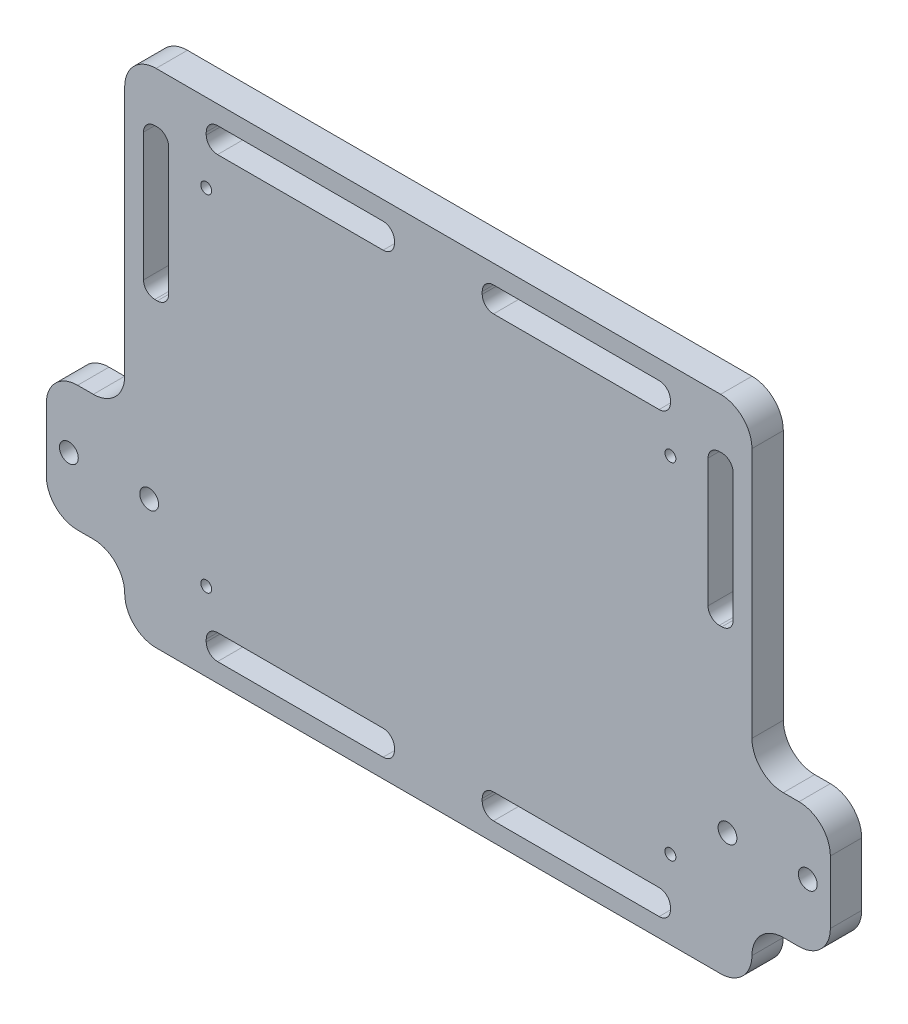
SolidWorks part; units mm, degrees
ref_plane "Front Plane" through (0, 0, 0) normal (0, 0, 1) x (1, 0, 0)
ref_plane "Top Plane" through (0, 0, 0) normal (0, 1, 0) x (1, 0, 0)
ref_plane "Right Plane" through (0, 0, 0) normal (1, 0, 0) x (0, 0, -1)
sketch "Sketch1" plane through (0, 0, 0) normal (0, 0, 1) x (1, 0, 0)
  line L0 (0, -50.8) -> (0, 50.8) construction
  line L1 (-63.5, 50.8) -> (63.5, 50.8)
  line L2 (-63.5, 50.8) -> (-63.5, -50.8)
  line L3 (-63.5, -50.8) -> (63.5, -50.8)
  line L4 (63.5, 50.8) -> (63.5, -50.8)
  line L5 (-63.5, 50.8) -> (63.5, -50.8) construction
  line L6 (-63.5, -50.8) -> (63.5, 50.8) construction
  line L7 (-63.5, 0) -> (63.5, 0) construction
  circle A0 centre (-46.99, 34.925) radius 1.1049
  circle A2 centre (-46.99, -34.925) radius 1.1049
  circle A3 centre (46.99, -34.925) radius 1.1049
  circle A4 centre (46.99, 34.925) radius 1.1049
  point P0 (0, 0)
  dimension "D3" = 2.2098
  dimension "D4" = 46.99
  dimension "D5" = 34.925
  dimension "D1" = 101.6
  dimension "D2" = 127
extrude "Boss-Extrude1" add sketch "Sketch1" along normal blind 6.35
sketch "Sketch2" plane through (0, 0, 6.35) normal (0, 0, 1) x (1, 0, 0)
  line L0 (-63.5, 44.45) -> (63.5, 44.45) construction
  line L1 (-63.5, 50.8) -> (-63.5, -50.8) construction
  line L2 (63.5, -50.8) -> (63.5, 50.8) construction
  line L3 (0, 50.8) -> (0, -50.8) construction
  line L4 (63.5, 50.8) -> (-63.5, 50.8) construction
  line L5 (-63.5, -50.8) -> (63.5, -50.8) construction
  line L6 (-57.15, 50.8) -> (-57.15, -50.8) construction
  line L7 (-63.5, 0) -> (63.5, 0) construction
  line L9 (-44.704, 46.99) -> (-11.176, 46.99)
  line L10 (-46.99, 44.704) -> (-46.99, 44.196)
  line L11 (-44.704, 41.91) -> (-11.176, 41.91)
  line L12 (-8.89, 44.704) -> (-8.89, 44.196)
  line L13 (-46.99, 46.99) -> (-8.89, 41.91) construction
  line L14 (-46.99, 41.91) -> (-8.89, 46.99) construction
  line L15 (-57.404, 40.64) -> (-56.896, 40.64)
  line L16 (-59.69, 38.354) -> (-59.69, 12.446)
  line L17 (-57.404, 10.16) -> (-56.896, 10.16)
  line L18 (-54.61, 38.354) -> (-54.61, 12.446)
  line L19 (-59.69, 40.64) -> (-54.61, 10.16) construction
  line L20 (-59.69, 10.16) -> (-54.61, 40.64) construction
  line L26 (-46.99, -41.91) -> (-8.89, -46.99) construction
  line L27 (-46.99, -46.99) -> (-8.89, -41.91) construction
  line L28 (-8.89, -44.704) -> (-8.89, -44.196)
  line L29 (-44.704, -41.91) -> (-11.176, -41.91)
  line L30 (-46.99, -44.704) -> (-46.99, -44.196)
  line L31 (-44.704, -46.99) -> (-11.176, -46.99)
  line L32 (46.99, -46.99) -> (8.89, -41.91) construction
  line L33 (46.99, -41.91) -> (8.89, -46.99) construction
  line L35 (59.69, 10.16) -> (54.61, 40.64) construction
  line L36 (59.69, 40.64) -> (54.61, 10.16) construction
  line L37 (46.99, 41.91) -> (8.89, 46.99) construction
  line L38 (46.99, 46.99) -> (8.89, 41.91) construction
  line L40 (57.15, 50.8) -> (57.15, -50.8) construction
  line L41 (44.704, -46.99) -> (11.176, -46.99)
  line L42 (46.99, -44.704) -> (46.99, -44.196)
  line L43 (44.704, -41.91) -> (11.176, -41.91)
  line L44 (8.89, -44.704) -> (8.89, -44.196)
  line L49 (54.61, 38.354) -> (54.61, 12.446)
  line L50 (57.404, 10.16) -> (56.896, 10.16)
  line L51 (59.69, 38.354) -> (59.69, 12.446)
  line L52 (57.404, 40.64) -> (56.896, 40.64)
  line L53 (8.89, 44.704) -> (8.89, 44.196)
  line L54 (44.704, 41.91) -> (11.176, 41.91)
  line L55 (46.99, 44.704) -> (46.99, 44.196)
  line L56 (44.704, 46.99) -> (11.176, 46.99)
  arc A0 (-56.896, 10.16) -> (-54.61, 12.446) centre (-56.896, 12.446) ccw
  arc A1 (-59.69, 12.446) -> (-57.404, 10.16) centre (-57.404, 12.446) ccw
  arc A2 (-57.404, 40.64) -> (-59.69, 38.354) centre (-57.404, 38.354) ccw
  arc A3 (-56.896, 40.64) -> (-54.61, 38.354) centre (-56.896, 38.354) cw
  arc A4 (-11.176, 41.91) -> (-8.89, 44.196) centre (-11.176, 44.196) ccw
  arc A5 (-11.176, 46.99) -> (-8.89, 44.704) centre (-11.176, 44.704) cw
  arc A6 (-46.99, 44.196) -> (-44.704, 41.91) centre (-44.704, 44.196) ccw
  arc A7 (-44.704, 46.99) -> (-46.99, 44.704) centre (-44.704, 44.704) ccw
  arc A12 (-44.704, -46.99) -> (-46.99, -44.704) centre (-44.704, -44.704) cw
  arc A13 (-46.99, -44.196) -> (-44.704, -41.91) centre (-44.704, -44.196) cw
  arc A14 (-11.176, -46.99) -> (-8.89, -44.704) centre (-11.176, -44.704) ccw
  arc A15 (-11.176, -41.91) -> (-8.89, -44.196) centre (-11.176, -44.196) cw
  arc A16 (11.176, -41.91) -> (8.89, -44.196) centre (11.176, -44.196) ccw
  arc A17 (11.176, -46.99) -> (8.89, -44.704) centre (11.176, -44.704) cw
  arc A18 (46.99, -44.196) -> (44.704, -41.91) centre (44.704, -44.196) ccw
  arc A19 (44.704, -46.99) -> (46.99, -44.704) centre (44.704, -44.704) ccw
  arc A24 (44.704, 46.99) -> (46.99, 44.704) centre (44.704, 44.704) cw
  arc A25 (46.99, 44.196) -> (44.704, 41.91) centre (44.704, 44.196) cw
  arc A26 (11.176, 46.99) -> (8.89, 44.704) centre (11.176, 44.704) ccw
  arc A27 (11.176, 41.91) -> (8.89, 44.196) centre (11.176, 44.196) cw
  arc A28 (56.896, 40.64) -> (54.61, 38.354) centre (56.896, 38.354) ccw
  arc A29 (57.404, 40.64) -> (59.69, 38.354) centre (57.404, 38.354) cw
  arc A30 (59.69, 12.446) -> (57.404, 10.16) centre (57.404, 12.446) cw
  arc A31 (56.896, 10.16) -> (54.61, 12.446) centre (56.896, 12.446) cw
  point P16 (-27.94, 44.45)
  point P21 (-57.15, 25.4)
  point P83 (-27.94, -44.45)
  point P150 (27.94, -44.45)
  point P152 (57.15, 25.4)
  point P153 (27.94, 44.45)
  dimension "D9" = 2.286
  dimension "D1" = 6.35
  dimension "D2" = 6.35
  dimension "D3" = 5.08
  dimension "D4" = 38.1
  dimension "D5" = 35.56
  dimension "D6" = 5.08
  dimension "D7" = 30.48
  dimension "D8" = 25.4
extrude "Cut-Extrude1" cut sketch "Sketch2" against normal through all
fillet "Fillet1" radius 6.35 4 edges at (-63.5, -50.8, 3.175) (63.5, -50.8, 3.175) (63.5, 50.8, 3.175) (-63.5, 50.8, 3.175)
sketch "Sketch4" plane through (0, 0, 6.35) normal (0, 0, 1) x (1, 0, 0)
  line L0 (-63.5, 44.45) -> (-63.5, -44.45) construction
  line L1 (-63.5, -12.7) -> (-79.375, -12.7)
  line L2 (-63.5, -12.7) -> (-63.5, -38.1)
  line L3 (-63.5, -38.1) -> (-79.375, -38.1)
  line L4 (-79.375, -12.7) -> (-79.375, -38.1)
  line L5 (-57.15, -50.8) -> (57.15, -50.8) construction
  dimension "D1" = 15.875
  dimension "D2" = 25.4
  dimension "D3" = 12.7
extrude "Boss-Extrude2" add sketch "Sketch4" against normal blind 6.35
sketch "Sketch5" plane through (0, 0, 6.35) normal (0, 0, 1) x (1, 0, 0)
  line L0 (-79.375, -25.4) -> (-63.5, -25.4) construction
  line L1 (-79.375, -12.7) -> (-79.375, -38.1) construction
  line L2 (-63.5, -12.7) -> (-63.5, -38.1) construction
  circle A0 centre (-74.803, -25.4) radius 1.905
  circle A1 centre (-58.547, -25.4) radius 1.905
  dimension "D1" = 3.81
  dimension "D2" = 3.81
  dimension "D3" = 4.572
  dimension "D4" = 20.828
extrude "Cut-Extrude2" cut sketch "Sketch5" against normal through all
mirror "Mirror1" about plane through (0, 0, 0) normal (1, 0, 0) of "Boss-Extrude2", "Cut-Extrude2"
fillet "Fillet2" radius 6.35 8 edges at (-79.375, -38.1, 3.175) (-63.5, -38.1, 3.175) (-79.375, -12.7, 3.175) (-63.5, -12.7, 3.175) (63.5, -12.7, 3.175) (63.5, -38.1, 3.175) (79.375, -38.1, 3.175) (79.375, -12.7, 3.175)
